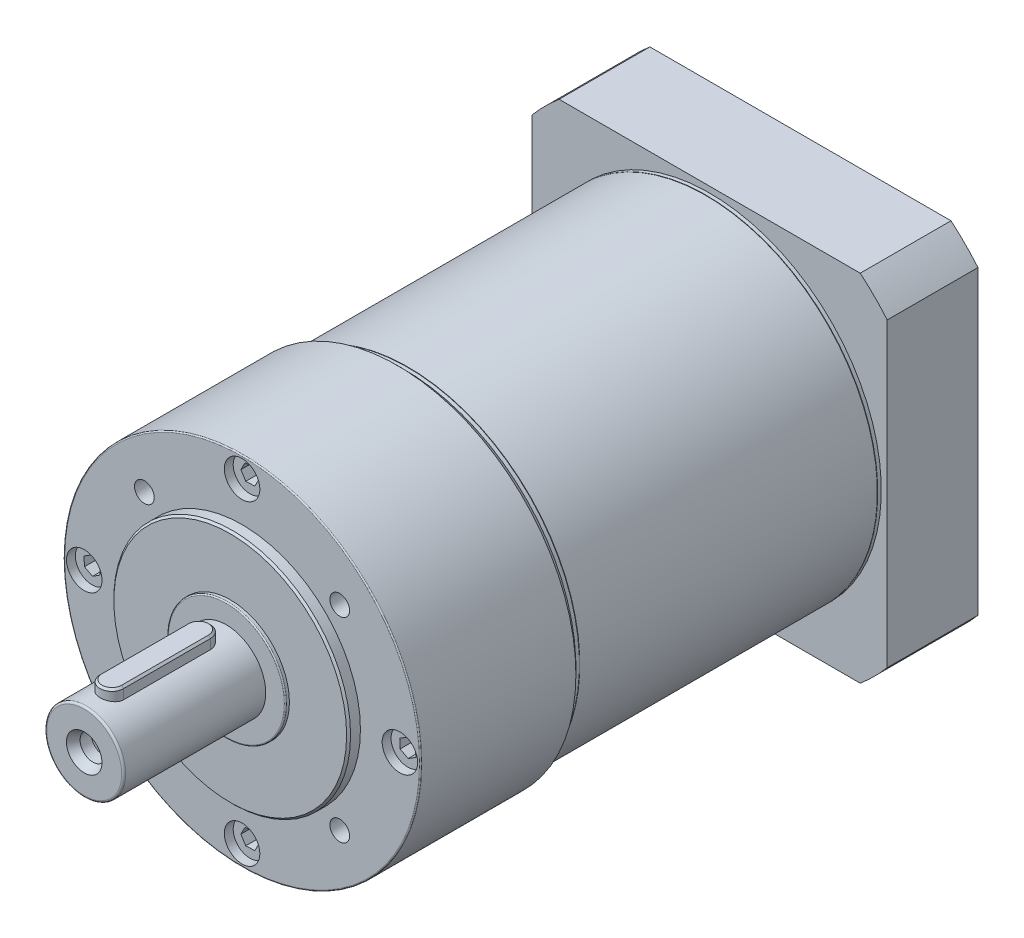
SolidWorks part; units mm, degrees
ref_plane "前视基准面" through (0, 0, 0) normal (0, 0, 1) x (1, 0, 0)
ref_plane "上视基准面" through (0, 0, 0) normal (0, 1, 0) x (1, 0, 0)
ref_plane "右视基准面" through (0, 0, 0) normal (1, 0, 0) x (0, 0, -1)
sketch "草图1" plane through (0, 0, 0) normal (0, 0, 1) x (1, 0, 0)
  circle A0 centre (0, 0) radius 45.25
extrude "凸台-拉伸1" add sketch "草图1" along normal blind 42
sketch "草图2" plane through (0, 0, 42) normal (0, 0, 1) x (1, 0, 0)
  circle A0 centre (0, 0) radius 30
extrude "凸台-拉伸2" add sketch "草图2" along normal blind 3
sketch "草图3" plane through (0, 0, 0) normal (0, 0, -1) x (-1, 0, 0)
  circle A0 centre (0, 0) radius 43.5
extrude "切除-拉伸1" cut sketch "草图3" against normal blind 1 flip side to cut
chamfer "倒角1" distance 1.65 angle 45 1 edges at (-45.25, 0, 1)
fillet "圆角1" radius 0.3 1 edges at (45.25, 0, 42)
ref_plane "基准面1" through (0, 0, -0.1) normal (0, 0, -1) x (-1, 0, 0)
sketch "草图4" plane through (0, 0, -0.1) normal (0, 0, -1) x (-1, 0, 0)
  circle A0 centre (0, 0) radius 43.5
extrude "凸台-拉伸3" add sketch "草图4" along normal blind 75.4 separate body
ref_plane "基准面2" through (0, 0, -75.6) normal (0, 0, -1) x (-1, 0, 0)
sketch "草图5" plane through (0, 0, -75.6) normal (0, 0, -1) x (-1, 0, 0)
  circle A0 centre (0, 0) radius 43.5
extrude "凸台-拉伸4" add sketch "草图5" along normal blind 0.9 separate body
sketch "草图6" plane through (0, 0, -76.5) normal (0, 0, -1) x (-1, 0, 0)
  line L1 (-38.1576, 45) -> (38.1576, 45)
  line L2 (-45, 38.1576) -> (-45, -38.1576)
  line L3 (-38.1576, -45) -> (38.1576, -45)
  line L4 (45, 38.1576) -> (45, -38.1576)
  arc A0 (-38.1576, 45) -> (-45, 38.1576) centre (0, 0) ccw
  arc A1 (-45, -38.1576) -> (-38.1576, -45) centre (0, 0) ccw
  arc A2 (38.1576, -45) -> (45, -38.1576) centre (0, 0) ccw
  arc A3 (45, 38.1576) -> (38.1576, 45) centre (0, 0) ccw
  dimension "D1" = 45
  dimension "D3" = 45
extrude "凸台-拉伸5" add sketch "草图6" along normal blind 23
sketch "草图7" plane through (0, 0, -99.5) normal (0, 0, -1) x (-1, 0, 0)
  circle A0 centre (0, 0) radius 35
extrude "切除-拉伸2" cut sketch "草图7" against normal blind 6
sketch "草图8" plane through (0, 0, -93.5) normal (0, 0, -1) x (-1, 0, 0)
  circle A0 centre (0, 0) radius 32
extrude "切除-拉伸3" cut sketch "草图8" against normal blind 20
sketch "草图9" plane through (0, 0, -99.5) normal (0, 0, -1) x (-1, 0, 0)
  line L0 (0, 0) -> (0, 40) construction
  line L1 (0, 0) -> (-13.6808, 37.5877) construction
  circle A0 centre (0, 0) radius 40 construction
  circle A1 centre (-13.6808, 37.5877) radius 4.5
  dimension "D1" = 20
extrude "切除-拉伸4" cut sketch "草图9" against normal blind 14
pattern_circular "阵列(圆周)1" count 4 over 360 about axis through (0, 0, 0) along (0, 0, 1) of "切除-拉伸4"
sketch "草图10" plane through (0, 0, -99.5) normal (0, 0, -1) x (-1, 0, 0)
  line L0 (0, 0) -> (-31.8198, 31.8198)
  circle A0 centre (0, 0) radius 45
hole_wizard "M5 螺纹孔1" positions "3D草图1" profile "草图11" tap size "M5" standard "GB"
sketch3d "3D草图1"
  point P0 (31.8198, 31.8198, -99.5)
sketch "草图11" plane through (31.8198, 31.8198, -99.5) normal (1, 0, 0) x (0, 1, 0)
  line L0 (0, 0) -> (0, 17.2618)
  line L1 (0, 17.2618) -> (2.1, 16)
  line L2 (2.1, 16) -> (2.1, 0)
  line L5 (2.1, 0) -> (0, 0)
  line L10 (0, 17.2618) -> (-2.1, 16) construction
  line L11 (0, -6.35) -> (0, 107.95) construction
  dimension "螺纹孔钻头直径" = 4.2
  dimension "螺纹孔钻头深度" = 16
  dimension "导头角度" = 118
pattern_circular "阵列(圆周)2" count 4 over 360 about axis through (0, 0, 0) along (0, 0, 1) of "M5 螺纹孔1"
sketch "草图12" plane through (0, 0, -85.5) normal (0, 0, -1) x (-1, 0, 0)
  line L1 (-12.6133, 39.6356) -> (-14.9205, 39.5362)
  line L2 (-14.9205, 39.5362) -> (-15.9881, 37.4883)
  line L3 (-15.9881, 37.4883) -> (-14.7484, 35.5399)
  line L4 (-14.7484, 35.5399) -> (-12.4411, 35.6393)
  line L5 (-12.4411, 35.6393) -> (-11.3735, 37.6871)
  line L6 (-11.3735, 37.6871) -> (-12.6133, 39.6356)
  circle A0 centre (-13.6808, 37.5877) radius 4.25
  circle A1 centre (-13.6808, 37.5877) radius 2 construction
  dimension "D1" = 4
extrude "凸台-拉伸6" add sketch "草图12" along normal blind 5
pattern_circular "阵列(圆周)3" count 4 over 360 about axis through (0, 0, 0) along (0, 0, 1) of "凸台-拉伸6"
sketch "草图13" plane through (0, 0, 42) normal (0, 0, 1) x (1, 0, 0)
  line L0 (0, 0) -> (0, -40) construction
  circle A0 centre (0, 0) radius 40 construction
  circle A1 centre (0, -40) radius 4.5
extrude "切除-拉伸5" cut sketch "草图13" against normal blind 7
pattern_circular "阵列(圆周)4" count 4 over 360 about axis through (0, 0, 0) along (0, 0, 1) of "切除-拉伸5"
sketch "草图14" plane through (0, 0, 35) normal (0, 0, 1) x (1, 0, 0)
  line L1 (1.0702, -37.9535) -> (-1.2372, -38.05)
  line L2 (-1.2372, -38.05) -> (-2.3074, -40.0965)
  line L3 (-2.3074, -40.0965) -> (-1.0702, -42.0465)
  line L4 (-1.0702, -42.0465) -> (1.2372, -41.95)
  line L5 (1.2372, -41.95) -> (2.3074, -39.9035)
  line L6 (2.3074, -39.9035) -> (1.0702, -37.9535)
  circle A0 centre (0, -40) radius 4.25
  circle A1 centre (0, -40) radius 2 construction
  dimension "D1" = 4
extrude "凸台-拉伸7" add sketch "草图14" along normal blind 5
pattern_circular "阵列(圆周)5" count 4 over 360 about axis through (0, 0, 0) along (0, 0, 1) of "凸台-拉伸7"
sketch "草图15" plane through (0, 0, 42) normal (0, 0, 1) x (1, 0, 0)
  line L0 (0, 0) -> (-24.7487, 24.7487)
  circle A0 centre (0, 0) radius 35
hole_wizard "M6 螺纹孔1" positions "3D草图2" profile "草图16" tap size "M6" standard "GB"
sketch3d "3D草图2"
  point P0 (-24.7487, 24.7487, 42)
sketch "草图16" plane through (-24.7487, 24.7487, 42) normal (1, 0, 0) x (0, -1, 0)
  line L0 (0, 0) -> (0, 18.5022)
  line L1 (0, 18.5022) -> (2.5, 17)
  line L2 (2.5, 17) -> (2.5, 0)
  line L5 (2.5, 0) -> (0, 0)
  line L10 (0, 18.5022) -> (-2.5, 17) construction
  line L11 (0, -6.35) -> (0, 107.95) construction
  dimension "螺纹孔钻头直径" = 5
  dimension "螺纹孔钻头深度" = 17
  dimension "导头角度" = 118
pattern_circular "阵列(圆周)6" count 4 over 360 about axis through (0, 0, 0) along (0, 0, 1) of "M6 螺纹孔1"
ref_plane "基准面3" through (0, 0, -92.5) normal (0, 0, -1) x (-1, 0, 0)
sketch "草图17" plane through (0, 0, -92.5) normal (0, 0, -1) x (-1, 0, 0)
  circle A0 centre (0, 0) radius 26
extrude "凸台-拉伸8" add sketch "草图17" against normal up to surface (19 mm away)
chamfer "倒角2" distance 1.5 angle 45 1 edges at (-26, 0, -92.5)
sketch "草图18" plane through (0, 0, -92.5) normal (0, 0, -1) x (-1, 0, 0)
  line L1 (-30.5825, 0.5) -> (30.8028, 0.5)
  line L2 (-30.5825, 0.5) -> (-30.5825, -0.5)
  line L3 (-30.5825, -0.5) -> (30.8028, -0.5)
  line L4 (30.8028, 0.5) -> (30.8028, -0.5)
  dimension "D1" = 0.5
  dimension "D2" = 1
extrude "切除-拉伸6" cut sketch "草图18" against normal up to surface (19 mm away)
sketch "草图19" plane through (0, 0, -99.5) normal (0, 0, -1) x (-1, 0, 0)
  circle A0 centre (0, 0) radius 9.5
extrude "切除-拉伸7" cut sketch "草图19" against normal blind 42
chamfer "倒角3" distance 0.5 angle 45 1 edges at (30, 0, 45)
sketch "草图20" plane through (0, 0, 45) normal (0, 0, 1) x (1, 0, 0)
  circle A0 centre (0, 0) radius 15
extrude "凸台-拉伸9" add sketch "草图20" along normal blind 1
fillet "圆角2" radius 0.3 1 edges at (15, 0, 46)
sketch "草图22" plane through (0, 0, 46) normal (0, 0, 1) x (1, 0, 0)
  circle A0 centre (0, 0) radius 10
extrude "凸台-拉伸10" add sketch "草图22" along normal blind 36
fillet "圆角3" radius 0.5 1 edges at (10, 0, 82)
sketch "草图23" plane through (0, 0, 0) normal (0, 1, 0) x (1, 0, 0)
  line L0 (-9.5, -82) -> (9.5, -82) construction
  line L1 (-3, -53) -> (-3, -75)
  line L2 (3, -53) -> (3, -75)
  arc A0 (-3, -75) -> (3, -75) centre (0, -75) ccw
  arc A1 (3, -53) -> (-3, -53) centre (0, -53) ccw
  dimension "D1" = 7
  dimension "D2" = 22
extrude "凸台-拉伸11" add sketch "草图23" along normal blind 12.5
chamfer "倒角4" distance 0.5 angle 45 4 edges at (-3, 12.5, 64) (0, 12.5, 78) (0, 12.5, 50) (3, 12.5, 64)
sketch "草图24" plane through (0, 0, 82) normal (0, 0, 1) x (1, 0, 0)
  circle A0 centre (0, 0) radius 4.5
sketch "草图25" plane through (0, 0, 82) normal (0, 0, 1) x (1, 0, 0)
  circle A0 centre (0, 0) radius 3.25
extrude "切除-拉伸8" cut sketch "草图25" against normal blind 5
ref_plane "基准面4" through (0, 0, 79.8) normal (0, 0, 1) x (1, 0, 0)
sketch "草图26" plane through (0, 0, 79.8) normal (0, 0, 1) x (1, 0, 0)
  circle A0 centre (0, 0) radius 3.25 construction
  circle A1 centre (0, 0) radius 3.25
loft "切除-放样1" cut profiles "草图26", "草图24"
hole_wizard "M6 螺纹孔2" positions "3D草图3" profile "草图27" tap size "M6" standard "GB"
sketch3d "3D草图3"
  line L0 (0, 0, 77) -> (0, 0, 79.8) construction
  point P0 (0, 0, 77)
sketch "草图27" plane through (0, 0, 77) normal (1, 0, 0) x (0, -1, 0)
  line L0 (0, 0) -> (0, 18.0022)
  line L1 (0, 18.0022) -> (2.5, 16.5)
  line L2 (2.5, 16.5) -> (2.5, 0)
  line L5 (2.5, 0) -> (0, 0)
  line L10 (0, 18.0022) -> (-2.5, 16.5) construction
  line L11 (0, -6.35) -> (0, 107.95) construction
  dimension "螺纹孔钻头直径" = 5
  dimension "螺纹孔钻头深度" = 16.5
  dimension "导头角度" = 118
